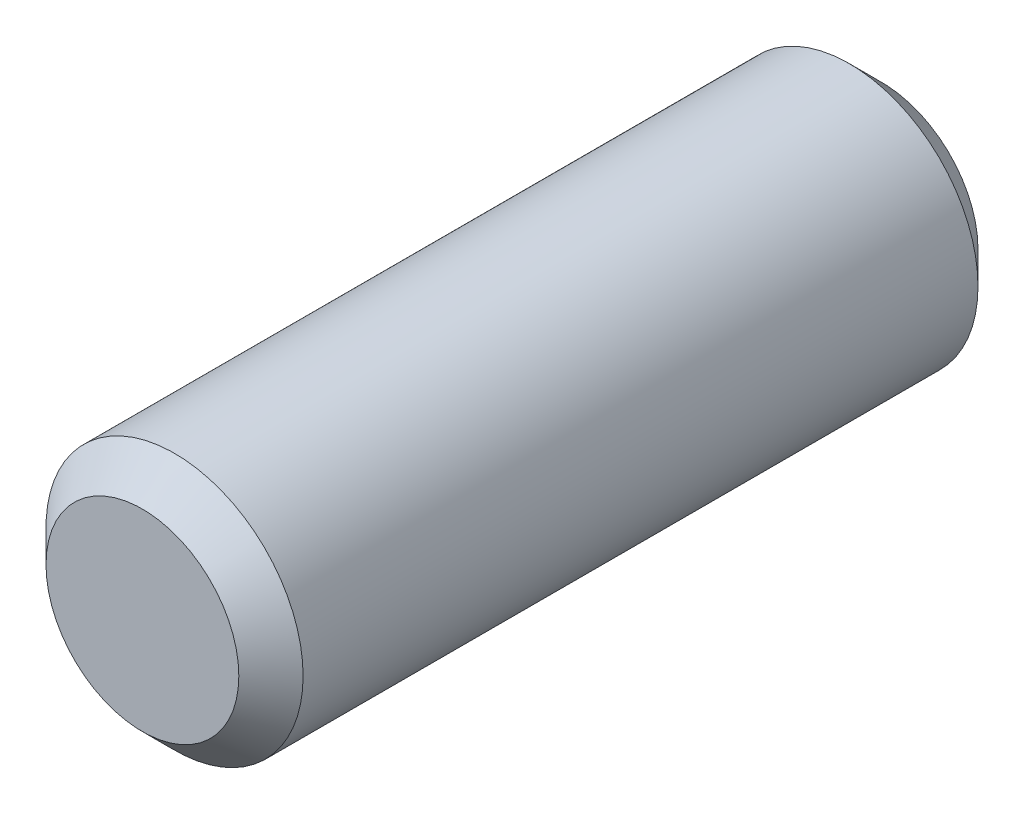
SolidWorks part; units mm, degrees
ref_plane "Plan de face" through (0, 0, 0) normal (0, 0, 1) x (1, 0, 0)
ref_plane "Plan de dessus" through (0, 0, 0) normal (0, 1, 0) x (1, 0, 0)
ref_plane "Plan de droite" through (0, 0, 0) normal (1, 0, 0) x (0, 0, -1)
sketch "Esquisse1" plane through (0, 0, 0) normal (0, 0, 1) x (1, 0, 0)
  circle A0 centre (0, 0) radius 4
  dimension "D1" = 8
extrude "Boss.-Extru.1" add sketch "Esquisse1" along normal blind 11 and the other way blind 12
chamfer "Chanfrein1" distance 1 angle 45 2 edges at (4, 0, -12) (4, 0, 11)
